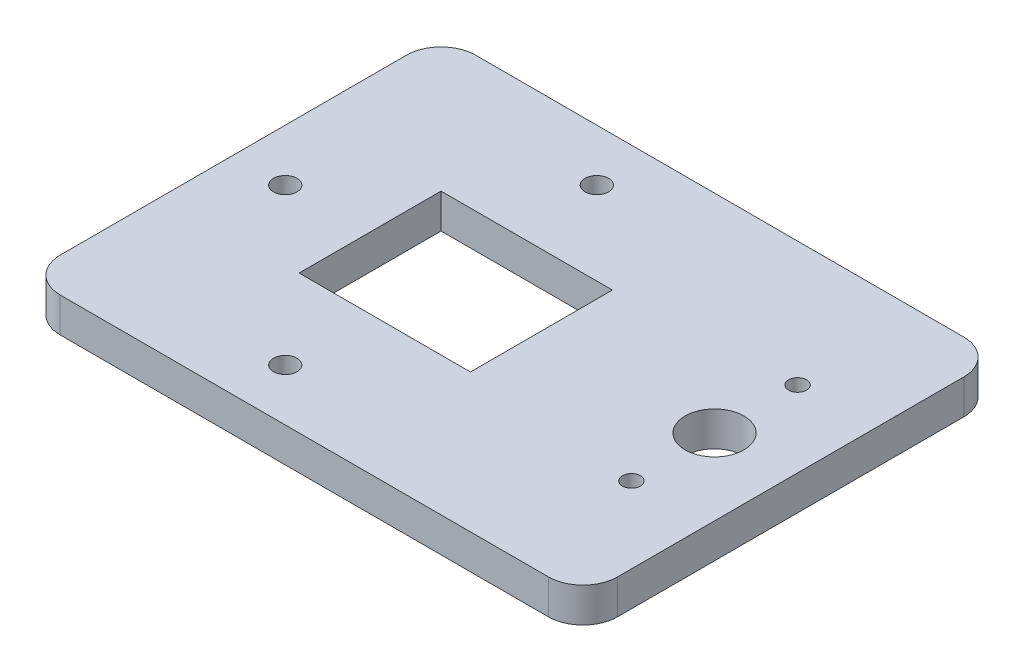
SolidWorks part; units mm, degrees
ref_plane "前视基准面" through (0, 0, 0) normal (0, 0, 1) x (1, 0, 0)
ref_plane "上视基准面" through (0, 0, 0) normal (0, 1, 0) x (1, 0, 0)
ref_plane "右视基准面" through (0, 0, 0) normal (1, 0, 0) x (0, 0, -1)
other "Configuration Table"
sketch "草图1" plane through (0, 0, 0) normal (0, 1, 0) x (1, 0, 0)
  line L1 (-100.5, -60) -> (60.5, -60)
  line L2 (-100.5, -60) -> (-100.5, 60)
  line L3 (-100.5, 60) -> (60.5, 60)
  line L4 (60.5, -60) -> (60.5, 60)
  line L5 (-100.5, -60) -> (60.5, 60) construction
  line L6 (-100.5, 60) -> (60.5, -60) construction
  dimension "D1" = 161
  dimension "D2" = 120
extrude "凸台-拉伸1" add sketch "草图1" along normal blind 10
fillet "圆角1" radius 10 2 edges at (60.5, 5, -60) (60.5, 5, 60)
sketch "草图2" plane through (0, 10, 0) normal (0, 1, 0) x (1, 0, 0)
  line L9 (-12, -20) -> (-61.5, -20)
  line L10 (-12, -20) -> (-12, 21)
  line L11 (-12, 21) -> (-61.5, 21)
  line L12 (-61.5, -20) -> (-61.5, 21)
  line L13 (-12, -20) -> (-61.5, 21) construction
  line L14 (-12, 21) -> (-61.5, -20) construction
  line L18 (-100.5, -60) -> (50.5, -60) construction
  dimension "D1" = 49.5
  dimension "D2" = 41
  dimension "D3" = 40
extrude "切除-拉伸1" cut sketch "草图2" against normal blind 10
sketch "草图3" plane through (0, 10, 0) normal (0, 1, 0) x (1, 0, 0)
  circle A0 centre (38.5, 0) radius 8.5
  dimension "D1" = 17
extrude "切除-拉伸2" cut sketch "草图3" against normal blind 10
fillet "圆角2" radius 10 2 edges at (-100.5, 5, -60) (-100.5, 5, 60)
sketch "草图5" plane through (0, 0, 0) normal (0, -1, 0) x (1, 0, 0)
  line L0 (-90.5, 60) -> (50.5, 60) construction
  line L1 (-100.5, -50) -> (-100.5, 50) construction
  line L2 (50.5, -60) -> (-90.5, -60) construction
  circle A0 centre (-40.5, 45) radius 3.4
  circle A1 centre (-85.5, 0) radius 3.4
  circle A2 centre (-40.5, -45) radius 3.4
  dimension "D1" = 6.8
  dimension "D2" = 6.8
  dimension "D3" = 6.8
  dimension "D4" = 15
  dimension "D5" = 15
  dimension "D6" = 15
extrude "切除-拉伸4" cut sketch "草图5" against normal through all
sketch "草图6" plane through (0, 10, 0) normal (0, 1, 0) x (1, 0, 0)
  line L0 (38.5, 0) -> (38.5, 60) construction
  line L1 (50.5, 60) -> (-90.5, 60) construction
  line L2 (38.5, 0) -> (38.5, -60) construction
  line L3 (-90.5, -60) -> (50.5, -60) construction
  circle A0 centre (38.5, 24) radius 2.6
  circle A1 centre (38.5, -24) radius 2.6
  circle A2 centre (38.5, 0) radius 8.5 construction
  dimension "D1" = 5.2
  dimension "D2" = 5.2
  dimension "D3" = 24
  dimension "D4" = 24
extrude "切除-拉伸5" cut sketch "草图6" against normal blind 10
